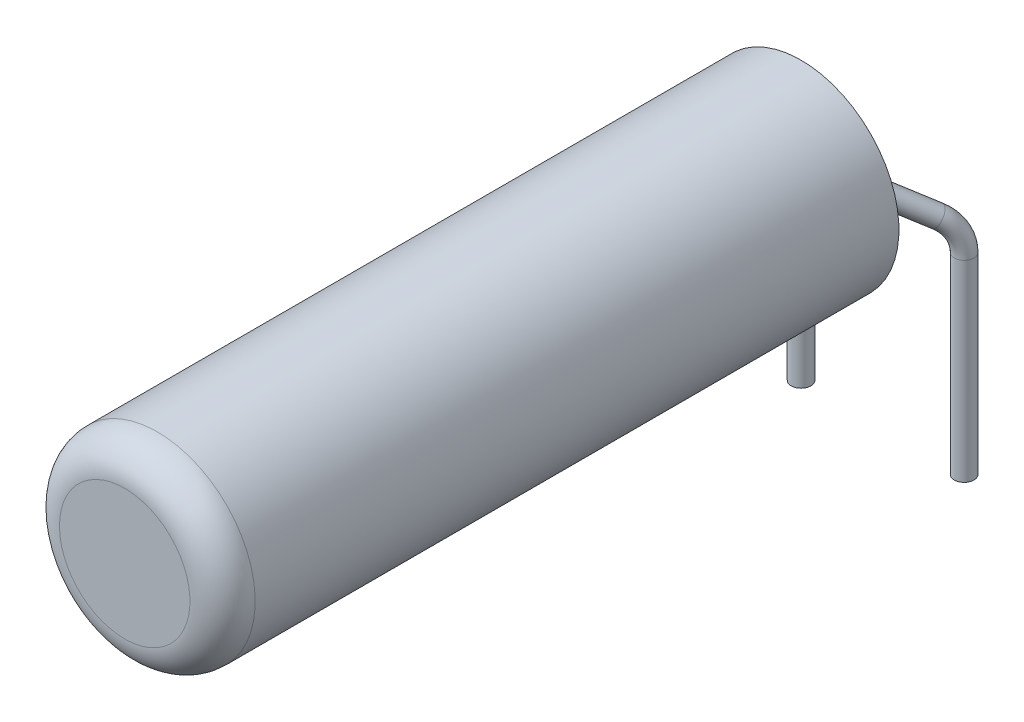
SolidWorks part; units mm, degrees
ref_plane "Front" through (0, 0, 0) normal (0, 0, 1) x (1, 0, 0)
ref_plane "Top" through (0, 0, 0) normal (0, 1, 0) x (1, 0, 0)
ref_plane "Right" through (0, 0, 0) normal (1, 0, 0) x (0, 0, -1)
sketch "Эскиз1" plane through (0, 0, 0) normal (1, 0, 0) x (0, 0, -1)
  line L0 (-11.6173, 1.5) -> (-1.45, 1.5)
  line L1 (-1.25, 0) -> (-11.6173, 0)
  line L2 (-1.45, 0.2) -> (-1.45, 1.5)
  line L3 (-1.45, 1.5) -> (-11.6173, 1.5) construction
  line L4 (-11.6173, 0) -> (-11.6173, 1.5)
  line L5 (-1.25, 0) -> (-1.25, 0.2)
  line L6 (-1.25, 0.2) -> (-1.45, 0.2)
  dimension "D1" = 1.25
  dimension "D2" = 10.3673
  dimension "D3" = 3
  dimension "D4" = 0.2
  dimension "D5" = 0.2
revolve "Повернуть1" add sketch "Эскиз1" angle 360 about L3
sketch "Эскиз2" plane through (0, 0, 1.45) normal (0, 0, -1) x (-1, 0, 0)
  line L0 (-1.5, 1.5) -> (1.5, 1.5) construction
  circle A0 centre (-0.55, 1.5) radius 0.15
  circle A1 centre (0, 1.5) radius 1.5 construction
  dimension "D2" = 0.3
  dimension "D1" = 0.55
sketch3d "Трехмерный эскиз1"
  line L0 (0.55, 1.5, 1.45) -> (0.55, 1.5, 1.2076)
  line L1 (0.6807, 1.3666, 0.7726) -> (1.0784, 0.961, 0.2329)
  line L2 (1.25, 0.4476, 0) -> (1.25, -2.5, 0)
  line L3 (0, 0, 0) -> (1.25, 0, 0) construction
  arc A0 (0.55, 1.5, 1.2076) -> (0.6807, 1.3666, 0.7726) centre (0.97, 1.0715, 1.2076) ccw
  arc A1 (1.0784, 0.961, 0.2329) -> (1.25, 0.4476, 0) centre (0.8941, 0.4476, 0.483) ccw
  point P10 (0.55, 1.5, 0.95)
  point P11 (0.5415, 0.6515, 1.2076)
  point P14 (1.25, 0.7859, 0)
  point P15 (0.411, 0.4476, 0.1271)
  dimension "D4" = 0.6
  dimension "D1" = 1.25
  dimension "D2" = 0.5
  dimension "D3" = 1
  dimension "D5" = 2.5
sweep "По траектории1" add profiles "Эскиз2" path "Трехмерный эскиз1"
mirror "Зеркальное отражение1" about plane through (0, 0, 0) normal (1, 0, 0) of "По траектории1"
fillet "Скругление1" radius 0.5 1 edges at (-1.5, 1.5, 11.6173)
